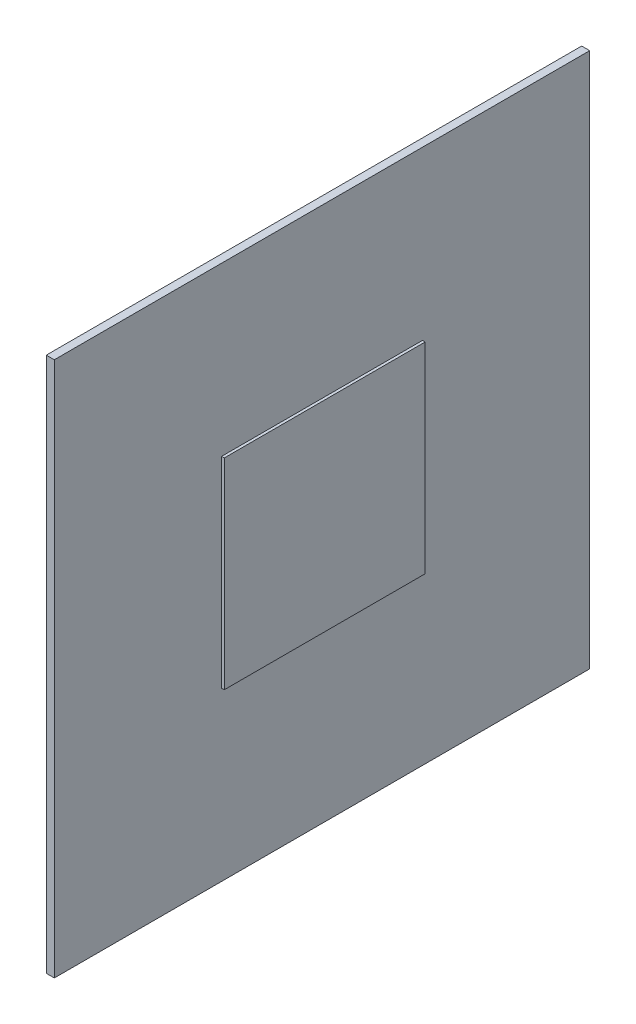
SolidWorks part; units mm, degrees
ref_plane "Front Plane" through (0, 0, 0) normal (0, 0, 1) x (1, 0, 0)
ref_plane "Top Plane" through (0, 0, 0) normal (0, 1, 0) x (1, 0, 0)
ref_plane "Right Plane" through (0, 0, 0) normal (1, 0, 0) x (0, 0, -1)
sketch "Sketch1" plane through (0, 0, 0) normal (1, 0, 0) x (0, 0, -1)
  line L1 (0, 0) -> (50.8, 0)
  line L2 (0, 0) -> (0, 50.8)
  line L3 (0, 50.8) -> (50.8, 50.8)
  line L4 (50.8, 0) -> (50.8, 50.8)
  dimension "D1" = 50.8
  dimension "D2" = 50.8
extrude "Boss-Extrude1" add sketch "Sketch1" along normal blind 0.762
sketch "Sketch2" plane through (0.762, 0, 0) normal (1, 0, 0) x (0, 0, -1)
  line L0 (0, 50.8) -> (0, 0) construction
  line L1 (15.875, 34.925) -> (34.925, 34.925)
  line L2 (15.875, 34.925) -> (15.875, 15.875)
  line L3 (15.875, 15.875) -> (34.925, 15.875)
  line L4 (34.925, 34.925) -> (34.925, 15.875)
  line L5 (50.8, 0) -> (50.8, 50.8) construction
  line L6 (50.8, 50.8) -> (0, 50.8) construction
  dimension "D1" = 15.875
  dimension "D2" = 15.875
  dimension "D3" = 19.05
  dimension "D4" = 15.875
extrude "Boss-Extrude2" add sketch "Sketch2" along normal blind 0.254
